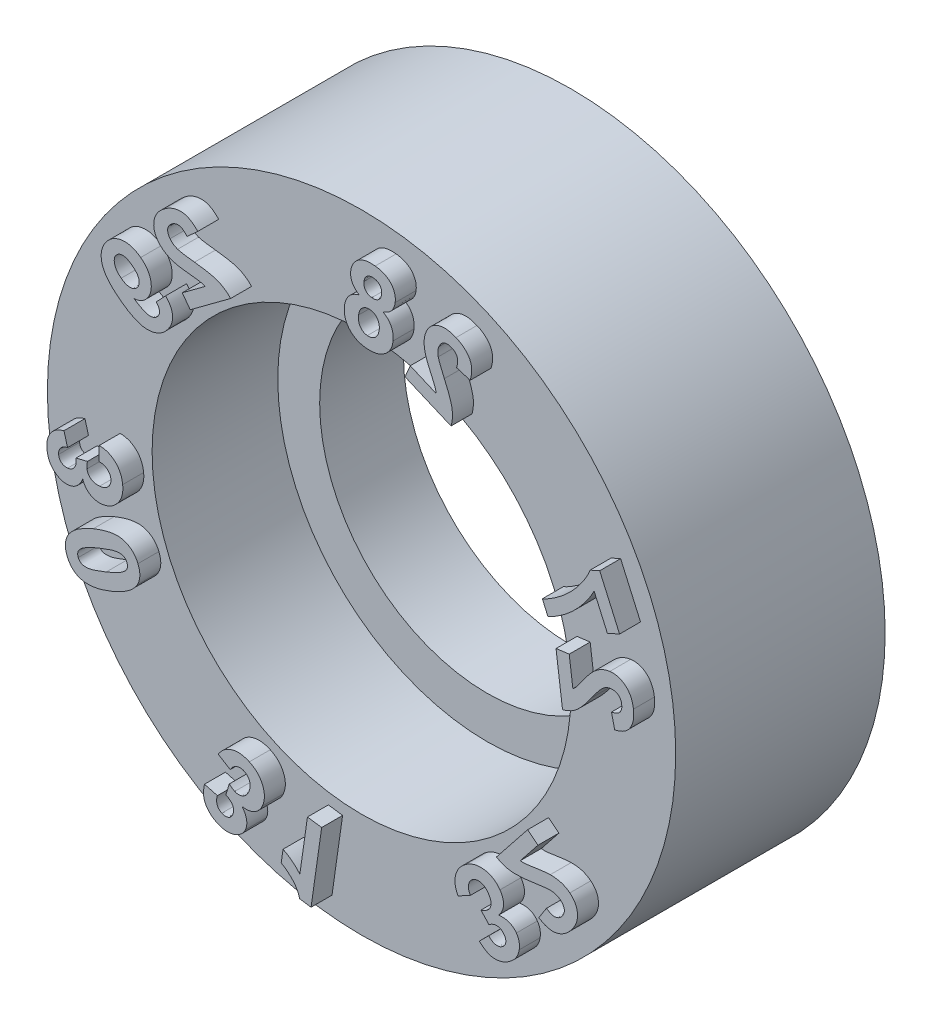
SolidWorks part; units mm, degrees
ref_plane "Front Plane" through (0, 0, 0) normal (0, 0, 1) x (1, 0, 0)
ref_plane "Top Plane" through (0, 0, 0) normal (0, 1, 0) x (1, 0, 0)
ref_plane "Right Plane" through (0, 0, 0) normal (1, 0, 0) x (0, 0, -1)
imported_body "Imported1"
other "DeleteFace2"
sketch "Sketch1" plane through (0, 0, 0) normal (0, 0, 1) x (1, 0, 0)
  line L0 (0, 0) -> (0, 8.7827) construction
  line L1 (0, 0) -> (7.606, 4.3913) construction
  line L2 (0, 0) -> (7.606, -4.3913) construction
  line L3 (0, 0) -> (0, -8.7827) construction
  line L4 (0, 0) -> (-7.606, -4.3913) construction
  line L5 (0, 0) -> (-7.606, 4.3913) construction
  circle A0 centre (0, 0) radius 5.3057 construction
  text T0 "27   28   29   30   31   32" font "Arial" height 1.8
  point P11 (0, 0)
  dimension "D1" = 6
extrude "Boss-Extrude1" add sketch "Sketch1" along normal blind 0.5
